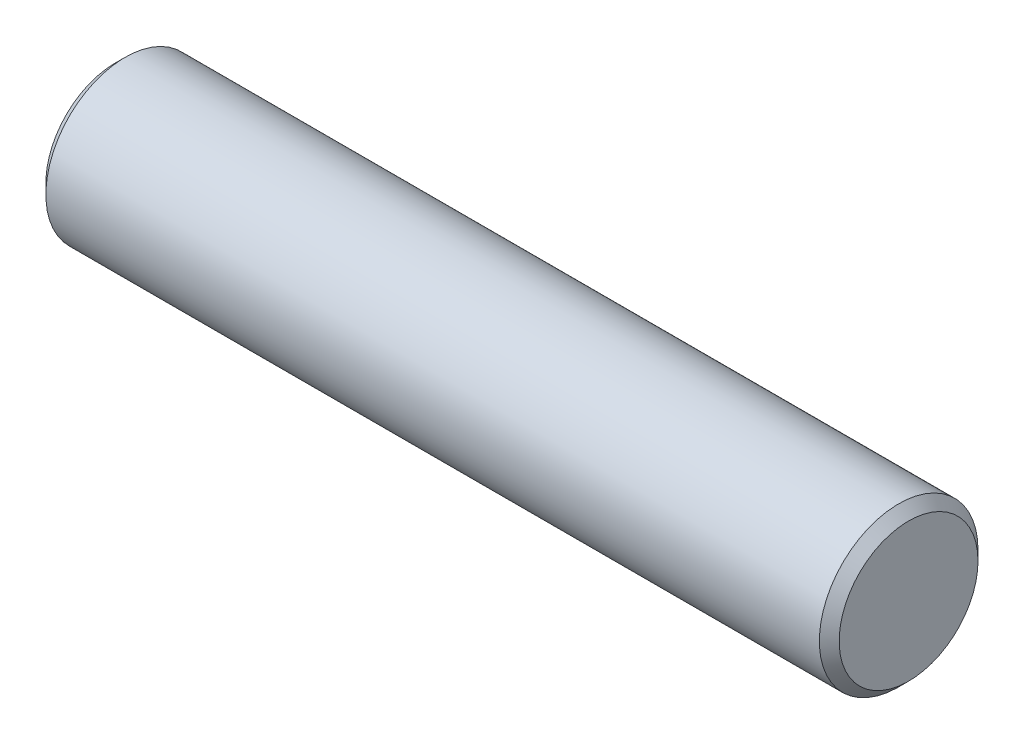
SolidWorks part; units mm, degrees
ref_plane "Plan de face" through (0, 0, 0) normal (0, 0, 1) x (1, 0, 0)
ref_plane "Plan de dessus" through (0, 0, 0) normal (0, 1, 0) x (1, 0, 0)
ref_plane "Plan de droite" through (0, 0, 0) normal (1, 0, 0) x (0, 0, -1)
sketch "Esquisse1" plane through (0, 0, 0) normal (1, 0, 0) x (0, 0, -1)
  circle A0 centre (0, 0) radius 4
  dimension "D1" = 8
extrude "Boss.-Extru.1" add sketch "Esquisse1" along normal blind 40
chamfer "Chanfrein1" distance 0.5 angle 45 2 edges at (0, 0, -4) (40, 0, -4)
